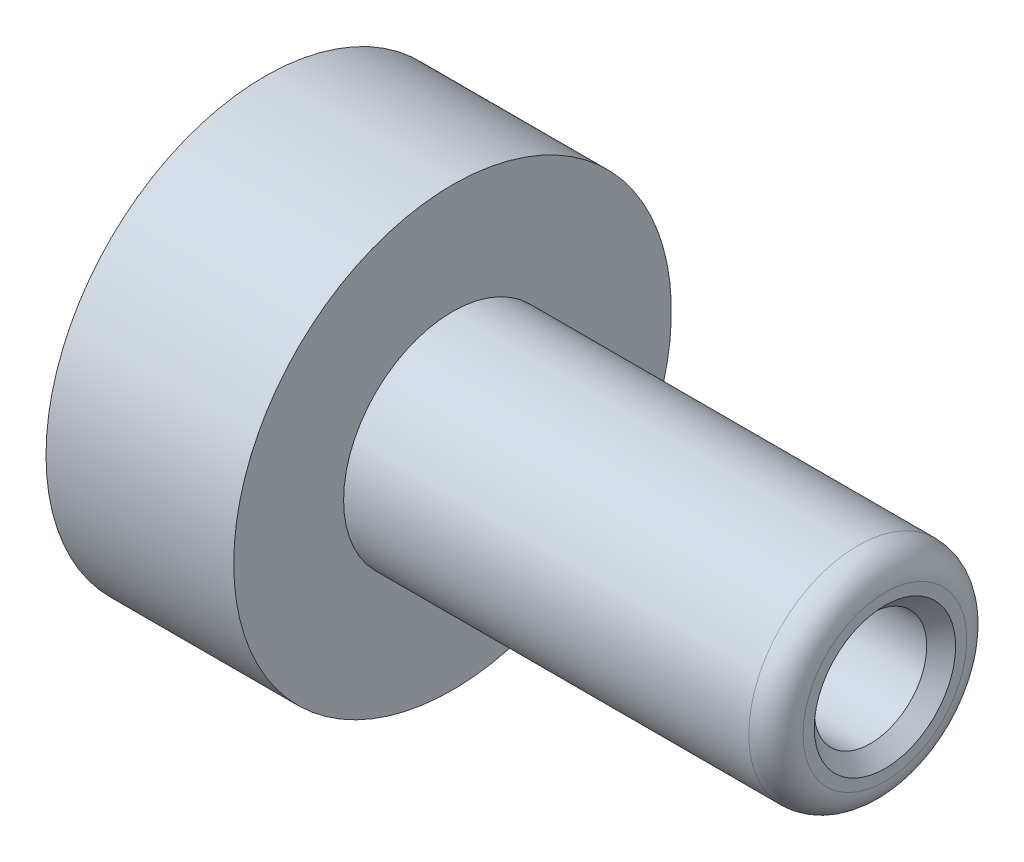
SolidWorks part; units mm, degrees
ref_plane "Front Plane" through (0, 0, 0) normal (0, 0, 1) x (1, 0, 0)
ref_plane "Top Plane" through (0, 0, 0) normal (0, 1, 0) x (1, 0, 0)
ref_plane "Right Plane" through (0, 0, 0) normal (1, 0, 0) x (0, 0, -1)
sketch "Sketch1" plane through (0, 0, 0) normal (0, 0, 1) x (1, 0, 0)
  line L0 (0, 0) -> (102.3864, 0) construction
  line L1 (0, 3.9751) -> (0, 12.7)
  line L2 (0, 12.7) -> (10.8966, 12.7)
  line L3 (10.8966, 12.7) -> (10.8966, 6.3246)
  line L4 (10.8966, 6.3246) -> (34.417, 6.3246)
  line L5 (35.9918, 4.7498) -> (35.9918, 0)
  line L6 (35.9918, 0) -> (21.8948, 0)
  line L7 (0, 3.9751) -> (21.8948, 3.9751)
  line L8 (21.8948, 3.9751) -> (21.8948, 0)
  arc A0 (35.9918, 4.7498) -> (34.417, 6.3246) centre (34.417, 4.7498) ccw
  dimension "D5" = 1.5748
  dimension "D1" = 10.8966
  dimension "D2" = 25.4
  dimension "D3" = 21.8948
  dimension "D4" = 7.9502
  dimension "D6" = 35.9918
  dimension "D7" = 12.6492
revolve "Revolve1" add sketch "Sketch1" angle 360 about L0
sketch "Sketch2" plane through (0, 0, 0) normal (-1, 0, 0) x (0, 0, 1)
  line L0 (0, 0) -> (0, 9.7644) construction
  circle A0 centre (-7.1374, 0) radius 1.6129
  circle A1 centre (7.1374, 0) radius 1.6129
  dimension "D2" = 3.2258
  dimension "D1" = 14.2748
extrude "Cut-Extrude1" cut sketch "Sketch2" against normal blind 6.35
sketch "Sketch3" plane through (35.9918, 0, 0) normal (1, 0, 0) x (0, 0, -1)
  circle A0 centre (0, 0) radius 3.2639
  dimension "D1" = 6.5278
extrude "Cut-Extrude2" cut sketch "Sketch3" against normal through all
chamfer "Chamfer1" distance 0.8382 angle 45 1 edges at (35.9918, 0, -3.2639)
